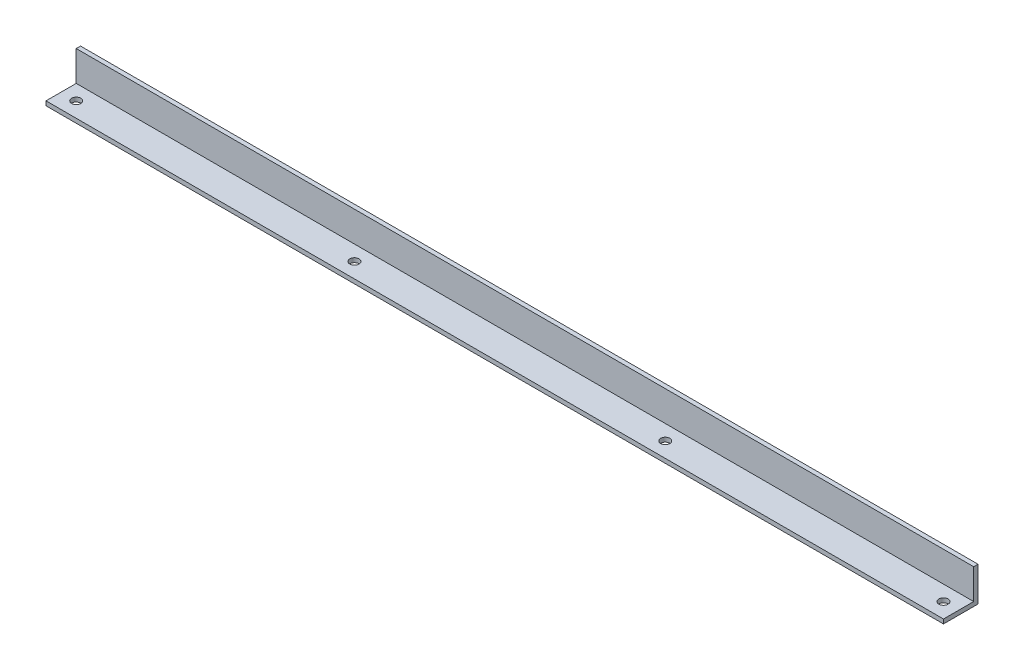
SolidWorks part; units mm, degrees
ref_plane "Front Plane" through (0, 0, 0) normal (0, 0, 1) x (1, 0, 0)
ref_plane "Top Plane" through (0, 0, 0) normal (0, 1, 0) x (1, 0, 0)
ref_plane "Right Plane" through (0, 0, 0) normal (1, 0, 0) x (0, 0, -1)
sketch "Sketch1" plane through (0, 0, 0) normal (0, 1, 0) x (1, 0, 0)
  line L1 (-330.2, 12.7) -> (330.2, 12.7)
  line L2 (-330.2, 12.7) -> (-330.2, -12.7)
  line L3 (-330.2, -12.7) -> (330.2, -12.7)
  line L4 (330.2, 12.7) -> (330.2, -12.7)
  line L5 (-330.2, 12.7) -> (330.2, -12.7) construction
  line L6 (-330.2, -12.7) -> (330.2, 12.7) construction
  point P0 (0, 0)
  dimension "D1" = 660.4
  dimension "D2" = 25.4
extrude "Boss-Extrude1" add sketch "Sketch1" along normal blind 3.175
sketch "Sketch2" plane through (0, 3.175, 0) normal (0, 1, 0) x (1, 0, 0)
  line L0 (-330.2, 12.7) -> (-330.2, 9.525)
  line L1 (-330.2, 12.7) -> (-330.2, -12.7) construction
  line L2 (-330.2, 9.525) -> (330.2, 9.525)
  line L3 (330.2, -12.7) -> (330.2, 12.7) construction
  line L4 (330.2, 9.525) -> (330.2, 12.7)
  line L5 (330.2, 12.7) -> (-330.2, 12.7)
  dimension "D1" = 3.175
extrude "Boss-Extrude2" add sketch "Sketch2" along normal blind 22.225
sketch "Sketch3" plane through (0, 3.175, 0) normal (0, 1, 0) x (1, 0, 0)
  line L0 (-330.2, -1.5875) -> (330.2, -1.5875) construction
  line L1 (-330.2, 9.525) -> (-330.2, -12.7) construction
  line L2 (330.2, -12.7) -> (330.2, 9.525) construction
  line L3 (-330.2, -12.7) -> (330.2, -12.7) construction
  circle A0 centre (-319.0875, -1.5875) radius 3.3782
  circle A1 centre (-114.3635, -1.5875) radius 3.3782
  circle A2 centre (319.0875, -1.5875) radius 3.3782
  circle A3 centre (114.3635, -1.5875) radius 3.3782
  dimension "D2" = 6.7564
  dimension "D3" = 6.7564
  dimension "D4" = 6.7564
  dimension "D5" = 6.7564
  dimension "D1" = 11.1125
  dimension "D6" = 11.1125
  dimension "D7" = 204.724
  dimension "D8" = 11.1125
  dimension "D9" = 204.724
extrude "Cut-Extrude1" cut sketch "Sketch3" against normal through all
